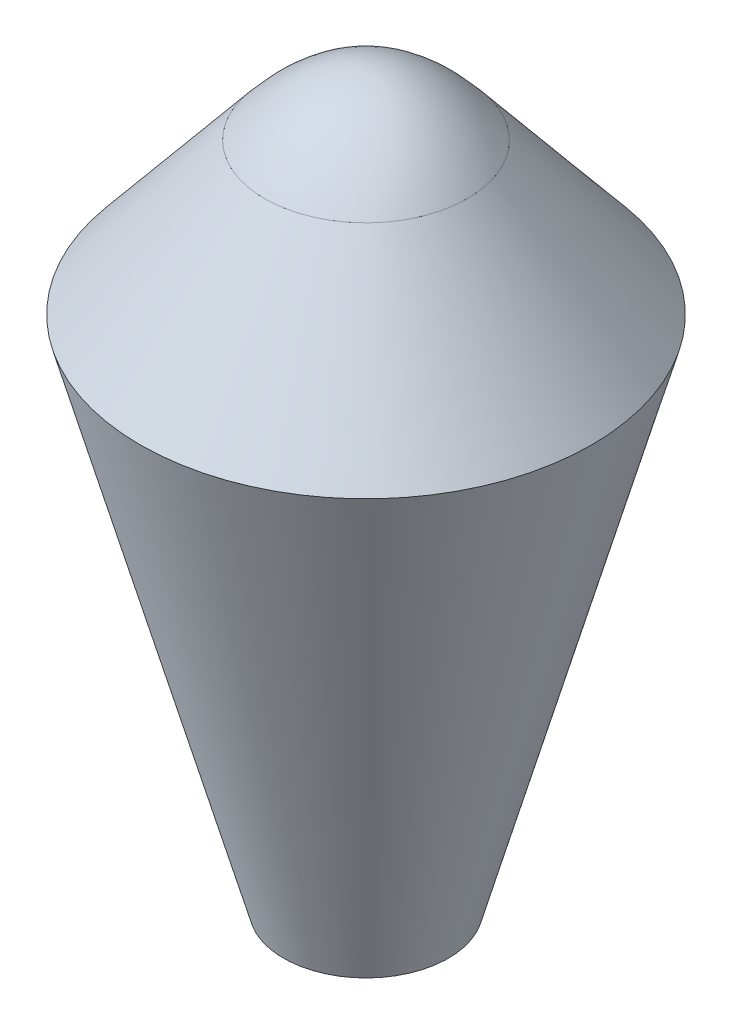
SolidWorks part; units mm, degrees
ref_plane "Front" through (0, 0, 0) normal (0, 0, 1) x (1, 0, 0)
ref_plane "Top" through (0, 0, 0) normal (0, 1, 0) x (1, 0, 0)
ref_plane "Right" through (0, 0, 0) normal (1, 0, 0) x (0, 0, -1)
sketch "Sketch1" plane through (0, 0, 0) normal (0, 0, 1) x (1, 0, 0)
  line L0 (0, 0) -> (0, 100) construction
  line L1 (11.3512, 0) -> (31.088, 71.0778)
  line L2 (31.088, 71.0778) -> (13.9563, 91.8668)
  line L3 (13.9563, 91.8668) -> (6.6179, 0)
  line L4 (6.6179, 0) -> (11.3512, 0)
  dimension "D1" = 100
revolve "Revolve1" add sketch "Sketch1" angle 360 about L0
surface "Surface-Fill3"
